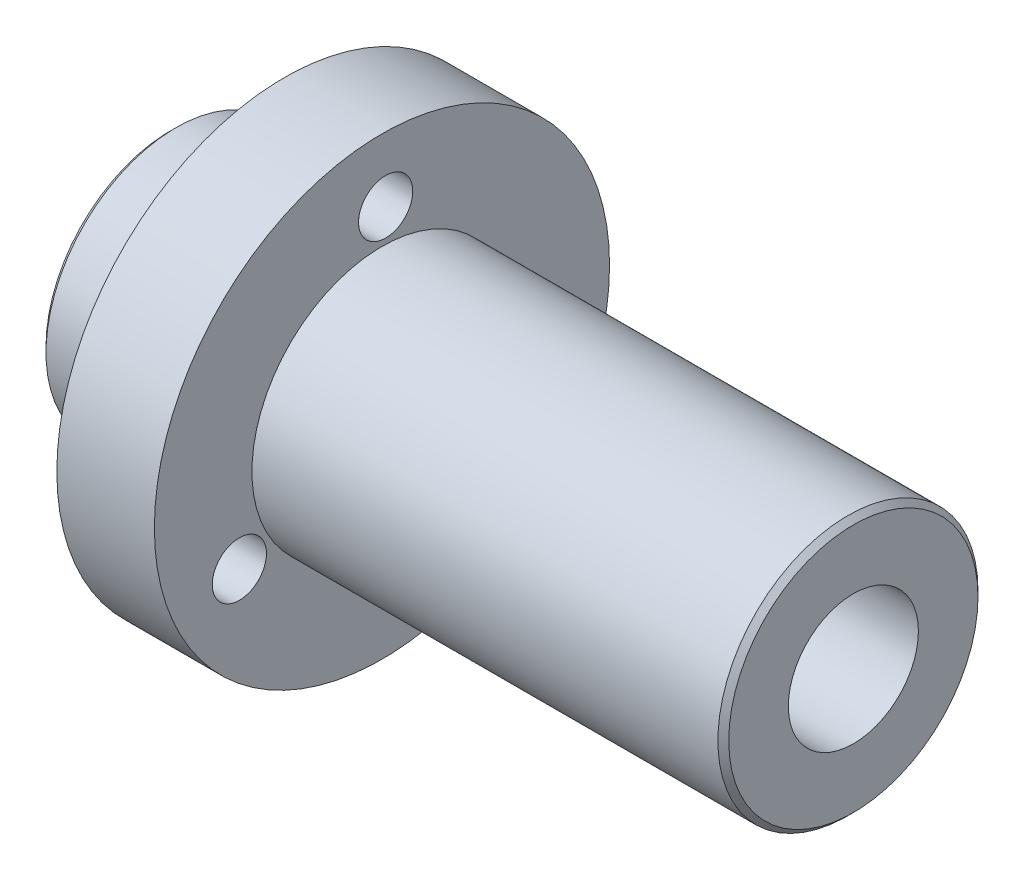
SolidWorks part; units mm, degrees
ref_plane "Plan de face" through (0, 0, 0) normal (0, 0, 1) x (1, 0, 0)
ref_plane "Plan de dessus" through (0, 0, 0) normal (0, 1, 0) x (1, 0, 0)
ref_plane "Plan de droite" through (0, 0, 0) normal (1, 0, 0) x (0, 0, -1)
sketch "Esquisse1" plane through (0, 0, 0) normal (0, 0, 1) x (1, 0, 0)
  line L0 (21, 42) -> (21, 0)
  line L1 (21, 0) -> (39, 0)
  line L2 (39, 0) -> (39, 42)
  line L3 (39, 42) -> (21, 42)
  line L4 (21, 0) -> (39, 0) construction
revolve "Révolution1" add sketch "Esquisse1" angle 360 about L4
sketch "Esquisse2" plane through (21, 0, 0) normal (-1, 0, 0) x (0, 0, 1)
  circle A0 centre (0, 0) radius 24
extrude "Extrusion1" add sketch "Esquisse2" along normal blind 21
sketch "Esquisse3" plane through (39, 0, 0) normal (1, 0, 0) x (0, 0, -1)
  circle A0 centre (0, 0) radius 24
extrude "Extrusion2" add sketch "Esquisse3" along normal blind 87
hole_wizard "Diamètre du perçage M10.0 (10)1" positions "Esquisse5" profile "Esquisse4" hole size "M10.0" standard "Ansi Métrique"
sketch "Esquisse5" plane through (39, 0, 0) normal (1, 0, 0) x (0, 0, -1)
  point P0 (25.6331, -15.5866)
sketch "Esquisse4" plane through (39, -15.5866, -25.6331) normal (0, 1, 0) x (0, 0, -1)
  line L0 (0, 0) -> (0, 18)
  line L1 (0, 18) -> (5, 18)
  line L2 (5, 18) -> (5, 0)
  line L5 (5, 0) -> (0, 0)
  line L11 (0, -6.35) -> (0, 107.95) construction
  dimension "Diamètre du perçage jusqu'au prochain" = 10
  dimension "Profondeur du perçage jusqu'au prochain" = 18
hole_wizard "Diamètre du perçage M10.0 (10)2" positions "Esquisse7" profile "Esquisse6" hole size "M10.0" standard "Ansi Métrique"
sketch "Esquisse7" plane through (39, 0, 0) normal (1, 0, 0) x (0, 0, -1)
  point P0 (0.6818, 29.9923)
sketch "Esquisse6" plane through (39, 29.9923, -0.6818) normal (0, 1, 0) x (0, 0, -1)
  line L0 (0, 0) -> (0, 18)
  line L1 (0, 18) -> (5, 18)
  line L2 (5, 18) -> (5, 0)
  line L5 (5, 0) -> (0, 0)
  line L11 (0, -6.35) -> (0, 107.95) construction
  dimension "Diamètre du perçage jusqu'au prochain" = 10
  dimension "Profondeur du perçage jusqu'au prochain" = 18
hole_wizard "Diamètre du perçage M10.0 (10)3" positions "Esquisse9" profile "Esquisse8" hole size "M10.0" standard "Ansi Métrique"
sketch "Esquisse9" plane through (39, 0, 0) normal (1, 0, 0) x (0, 0, -1)
  point P0 (-26.315, -14.4056)
sketch "Esquisse8" plane through (39, -14.4056, 26.315) normal (0, 1, 0) x (0, 0, -1)
  line L0 (0, 0) -> (0, 18)
  line L1 (0, 18) -> (5, 18)
  line L2 (5, 18) -> (5, 0)
  line L5 (5, 0) -> (0, 0)
  line L11 (0, -6.35) -> (0, 107.95) construction
  dimension "Diamètre du perçage jusqu'au prochain" = 10
  dimension "Profondeur du perçage jusqu'au prochain" = 18
hole_wizard "Perçage1" positions "Esquisse11" profile "Esquisse10" legacy
sketch "Esquisse11" plane through (0, 0, 0) normal (-1, 0, 0) x (0, 0, 1)
  point P0 (0, 0)
sketch "Esquisse10" plane through (0, 0, 0) normal (0, 1, 0) x (0, 0, 1)
  line L0 (0, 0) -> (0, 126)
  line L1 (0, 126) -> (12, 126)
  line L2 (12, 126) -> (12, 99)
  line L3 (12, 99) -> (18, 99)
  line L4 (18, 99) -> (18, 0)
  line L5 (18, 0) -> (0, 0)
  line L6 (0, 110) -> (0, -10) construction
  dimension "Diamètre" = 24
  dimension "Profondeur" = 126
  dimension "Diamètre chambrage" = 36
  dimension "Profondeur chambrage" = 99
chamfer "Chanfrein1" distance 1 angle 45 2 edges at (126, 0, -24) (0, 0, 24)
